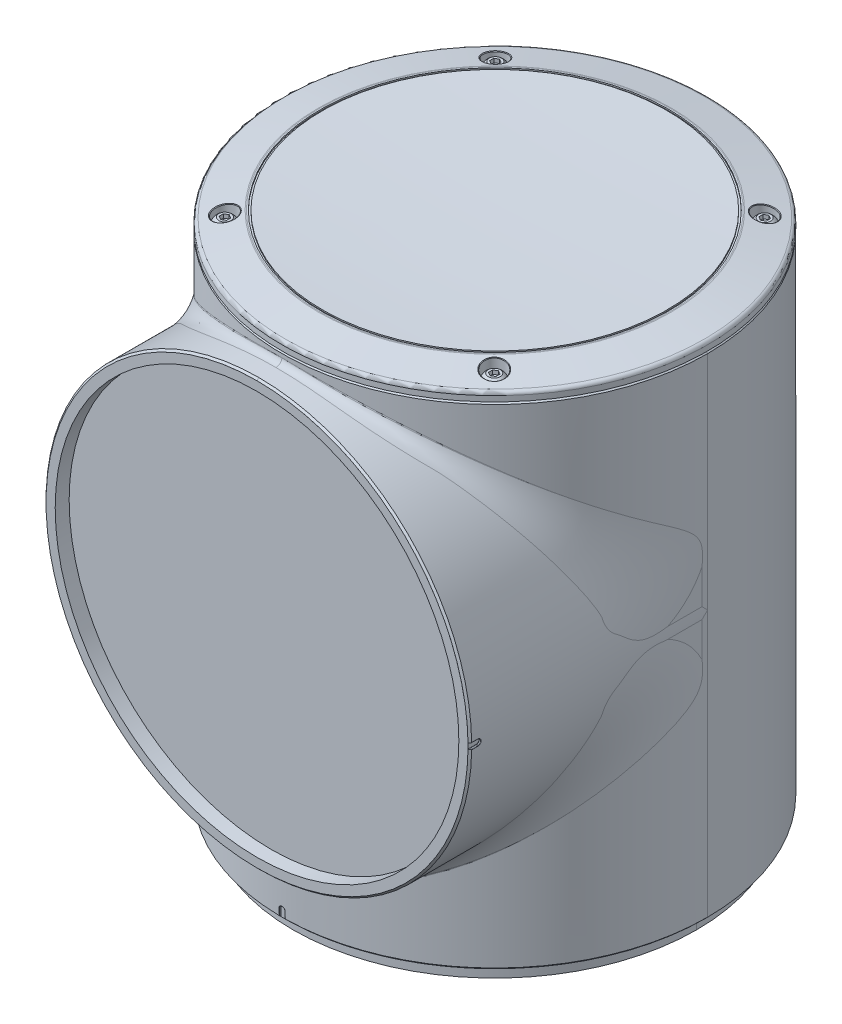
SolidWorks part; units mm, degrees
other "<4.0.07.2008582>-<输入1>"
other "<4.0.07.2008582>-<输入1>"
other "<4.0.07.2008582>-<输入1>"
other "<4.0.07.2008582>-<输入1>"
ref_plane "前视基准面" through (0, 0, 0) normal (0, 0, 1) x (1, 0, 0)
ref_plane "上视基准面" through (0, 0, 0) normal (0, 1, 0) x (1, 0, 0)
ref_plane "右视基准面" through (0, 0, 0) normal (1, 0, 0) x (0, 0, -1)
imported_body "FR5-V6.0-922-2-1-solid1"
imported_body "FR5-V6.0-922-25关节后盖-1-solid1"
other "删除面1"
other "删除面2"
other "删除面3"
other "删除面4"
ref_plane "前视基准面-4.0.07.2008582" through (36.6934, 215.65, 36.8455) normal (0, 0, 1) x (0, -1, 0)
ref_plane "上视基准面-4.0.07.2008582" through (36.6934, 215.65, 36.8455) normal (1, 0, 0) x (0, -1, 0)
ref_plane "右视基准面-4.0.07.2008582" through (36.6934, 215.65, 36.8455) normal (0, -1, 0) x (0, 0, -1)
inserted part "4.0.07.2008582"
move or copy body "实体-移动/复制4" placed by mates yes
ref_plane "前视基准面-4.0.07.20085823" through (36.8455, 215.65, -36.6934) normal (0, 0, 1) x (0, -1, 0)
ref_plane "上视基准面-4.0.07.20085823" through (36.8455, 215.65, -36.6934) normal (1, 0, 0) x (0, -1, 0)
ref_plane "右视基准面-4.0.07.20085823" through (36.8455, 215.65, -36.6934) normal (0, -1, 0) x (0, 0, -1)
inserted part "4.0.07.20085823"
move or copy body "实体-移动/复制6" placed by mates yes
ref_plane "前视基准面-4.0.07.20085824" through (-36.6934, 215.65, -36.8455) normal (0, 0, 1) x (0, -1, 0)
ref_plane "上视基准面-4.0.07.20085824" through (-36.6934, 215.65, -36.8455) normal (1, 0, 0) x (0, -1, 0)
ref_plane "右视基准面-4.0.07.20085824" through (-36.6934, 215.65, -36.8455) normal (0, -1, 0) x (0, 0, -1)
inserted part "4.0.07.20085824"
move or copy body "实体-移动/复制8" placed by mates yes
ref_plane "前视基准面-4.0.07.20085825" through (-36.8455, 215.65, 36.6934) normal (0, 0, 1) x (0, -1, 0)
ref_plane "上视基准面-4.0.07.20085825" through (-36.8455, 215.65, 36.6934) normal (1, 0, 0) x (0, -1, 0)
ref_plane "右视基准面-4.0.07.20085825" through (-36.8455, 215.65, 36.6934) normal (0, -1, 0) x (0, 0, -1)
inserted part "4.0.07.20085825"
move or copy body "实体-移动/复制10"
